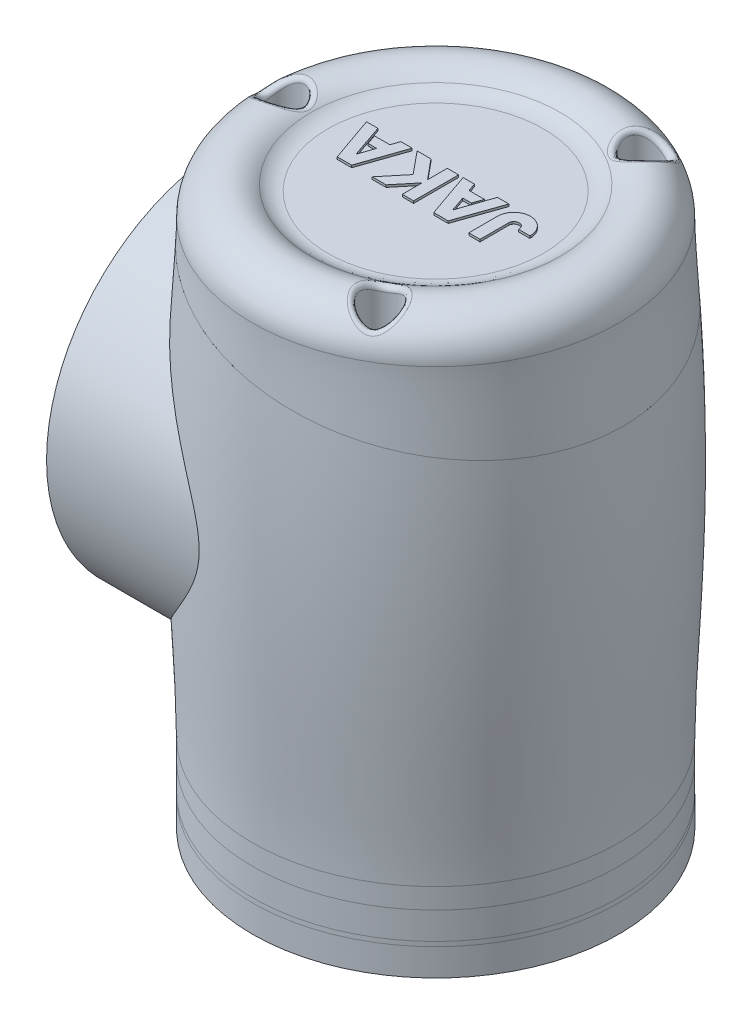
SolidWorks part; units mm, degrees
ref_plane "前视基准面" through (0, 0, 0) normal (0, 0, 1) x (1, 0, 0)
ref_plane "上视基准面" through (0, 0, 0) normal (0, 1, 0) x (1, 0, 0)
ref_plane "右视基准面" through (0, 0, 0) normal (1, 0, 0) x (0, 0, -1)
imported_body "01"
imported_body "02"
ref_plane "Plane1" through (0, 112.5, 0) normal (0, 1, 0) x (1, 0, 0)
sketch "Sketch1" plane through (0, 112.5, 0) normal (0, 1, 0) x (1, 0, 0)
  circle A0 centre (-33.5, 0) radius 4
  circle A1 centre (0, 0) radius 23.8397 construction
  circle A2 centre (16.75, 29.0119) radius 4
  circle A3 centre (16.75, -29.0119) radius 4
  point P10 (0, 0)
  dimension "D1" = 8
  dimension "D2" = 33.5
  dimension "D3" = 3
extrude "Extrude1" cut sketch "Sketch1" along normal through all
fillet "Fillet1" radius 1 3 edges at (19.403, 123.3023, 32.0054) (19.1259, 124.9905, -25.7939) (-30.5123, 124.7779, 2.6596)
sketch "草图1" plane through (-45.5, 0, 0) normal (-1, 0, 0) x (0, 0, 1)
  circle A0 centre (0, 108.5) radius 0.75
  circle A1 centre (0, 68) radius 40.5 construction
  circle A2 centre (0, 68) radius 40.5 construction
  dimension "D1" = 1.5
extrude "切除-拉伸1" cut sketch "草图1" against normal blind 3
ref_plane "基准面1" through (0, 13, 0) normal (0, -1, 0) x (-1, 0, 0)
sketch "草图2" plane through (0, 13, 0) normal (0, -1, 0) x (-1, 0, 0)
  circle A0 centre (40.5, 0) radius 0.75
  circle A1 centre (0, 0) radius 40.5 construction
  circle A2 centre (0, 0) radius 40.5 construction
  dimension "D1" = 1.5
extrude "切除-拉伸2" cut sketch "草图2" against normal blind 3
